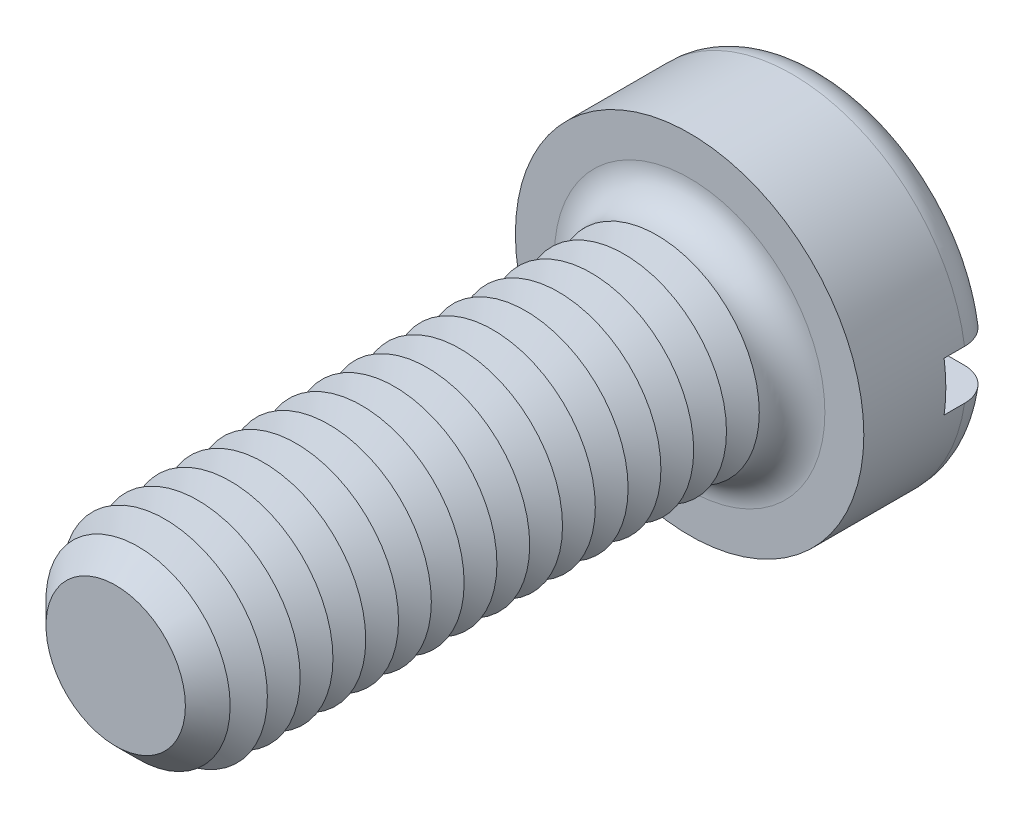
SolidWorks part; units mm, degrees
ref_plane "Front Plane" through (0, 0, 0) normal (0, 0, 1) x (1, 0, 0)
ref_plane "Top Plane" through (0, 0, 0) normal (0, 1, 0) x (1, 0, 0)
ref_plane "Right Plane" through (0, 0, 0) normal (1, 0, 0) x (0, 0, -1)
sketch "Sketch3" plane through (0, 0, 0) normal (0, 0, 1) x (1, 0, 0)
  circle A0 centre (0, 0) radius 4.25
  dimension "D1" = 8.5
extrude "Boss-Extrude2" add sketch "Sketch3" against normal blind 3.3
sketch "Sketch4" plane through (0, 0, 0) normal (0, 0, 1) x (1, 0, 0)
  circle A0 centre (0, 0) radius 2.5
  dimension "D1" = 5
extrude "Boss-Extrude3" add sketch "Sketch4" along normal blind 14
fillet "Fillet1" radius 0.8 2 edges at (4.25, 0, -3.3) (2.5, 0, 0)
chamfer "Chamfer1" distance 0.8 angle 45 1 edges at (2.5, 0, 14)
sketch "Sketch5" plane through (0, 0, 0) normal (1, 0, 0) x (0, 0, -1)
  line L0 (1.6944, 0) -> (-7.6738, 0) construction
sketch "Sketch6" plane through (0, 0, 0) normal (1, 0, 0) x (0, 0, -1)
  line L0 (-0.8, 2.5) -> (-1.2, 1.8072)
  line L1 (-1.2, 1.8072) -> (-1.6, 2.5)
  line L2 (-0.8, 2.5) -> (-13.2, 2.5) construction
  line L3 (-1.6, 2.5) -> (-0.8, 2.5)
  dimension "D1" = 0.8
revolve "Cut-Revolve1" cut sketch "Sketch6" angle 360 about L0
pattern_linear "LPattern1" count 16 spacing 0.8 along (0, 0, 1) of "Cut-Revolve1"
sketch "Sketch8" plane through (0, 0, -3.3) normal (0, 0, -1) x (-1, 0, 0)
  line L1 (4.25, -0.6) -> (-4.25, -0.6)
  line L2 (4.25, -0.6) -> (4.25, 0.6)
  line L3 (4.25, 0.6) -> (-4.25, 0.6)
  line L4 (-4.25, -0.6) -> (-4.25, 0.6)
  line L5 (4.25, -0.6) -> (-4.25, 0.6) construction
  line L6 (4.25, 0.6) -> (-4.25, -0.6) construction
  point P0 (0, 0)
  dimension "D1" = 8.5
  dimension "D2" = 1.2
extrude "Cut-Extrude1" cut sketch "Sketch8" against normal blind 1.3
